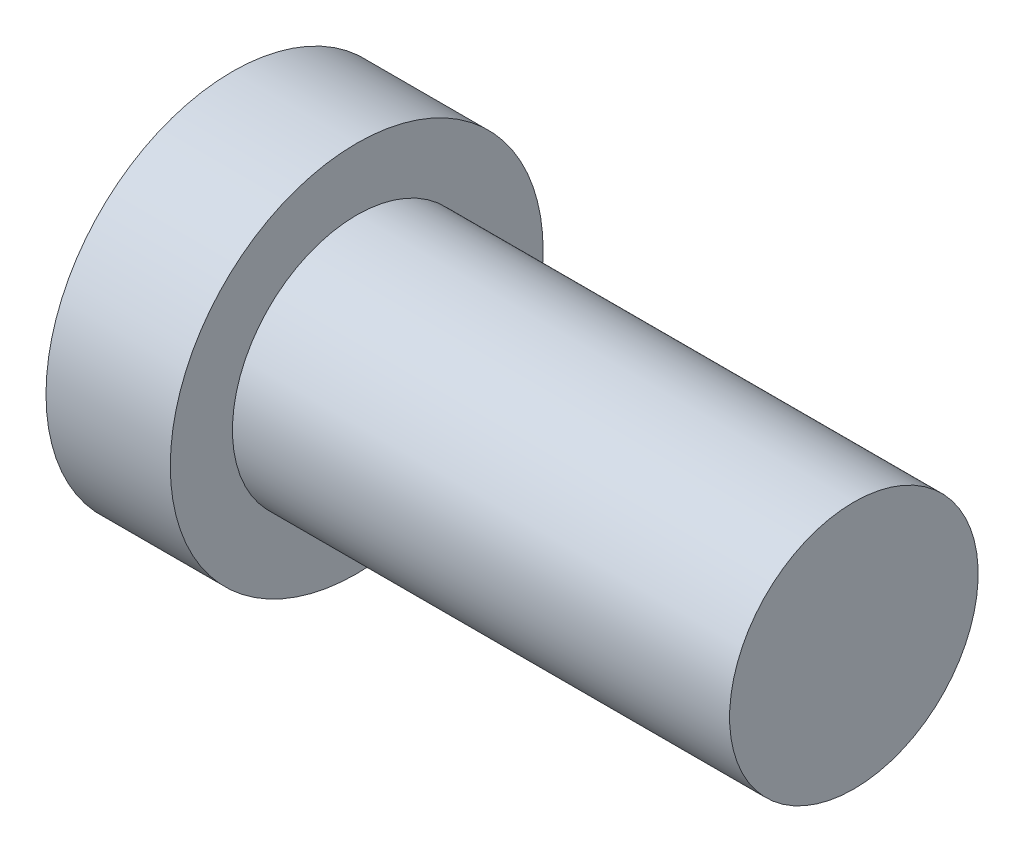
SolidWorks part; units mm, degrees
ref_plane "Front Plane" through (0, 0, 0) normal (0, 0, 1) x (1, 0, 0)
ref_plane "Top Plane" through (0, 0, 0) normal (0, 1, 0) x (1, 0, 0)
ref_plane "Right Plane" through (0, 0, 0) normal (1, 0, 0) x (0, 0, -1)
sketch "Sketch1" plane through (0, 0, 0) normal (0, 0, 1) x (1, 0, 0)
  line L0 (0, 0) -> (0, 3.81)
  line L1 (0, 3.81) -> (2.54, 3.81)
  line L2 (2.54, 3.81) -> (2.54, 2.54)
  line L3 (2.54, 2.54) -> (12.7, 2.54)
  line L4 (12.7, 2.54) -> (12.7, 0)
  line L5 (12.7, 0) -> (0, 0)
  dimension "D1" = 3.81
  dimension "D2" = 2.54
  dimension "D3" = 2.54
  dimension "D4" = 12.7
revolve "Revolve1" add sketch "Sketch1" angle 360 about L5
